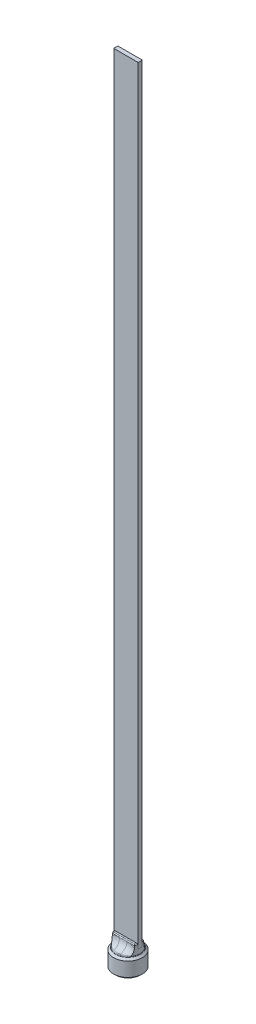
SolidWorks part; units mm, degrees
ref_plane "Front Plane" through (0, 0, 0) normal (0, 0, 1) x (1, 0, 0)
ref_plane "Top Plane" through (0, 0, 0) normal (0, 1, 0) x (1, 0, 0)
ref_plane "Right Plane" through (0, 0, 0) normal (1, 0, 0) x (0, 0, -1)
imported_body "Imported1"
sketch "Sketch1" plane through (0, 13.335, 0) normal (0, 1, 0) x (1, 0, 0)
  line L0 (-7.0111, 1.1938) -> (7.0111, 1.1938)
  line L1 (7.0111, -1.1938) -> (-7.0111, -1.1938)
  line L2 (6.8307, 1.1938) -> (-6.8307, 1.1938) construction
  line L3 (-6.8307, -1.1938) -> (6.8307, -1.1938) construction
  arc A0 (-7.0111, 1.1938) -> (-7.0111, -1.1938) centre (0, 0) ccw
  arc A1 (7.0111, -1.1938) -> (7.0111, 1.1938) centre (0, 0) ccw
  dimension "D1" = 14.224
extrude "Boss-Extrude1" add sketch "Sketch1" along normal offset from surface (443.865 mm away) 457.2
